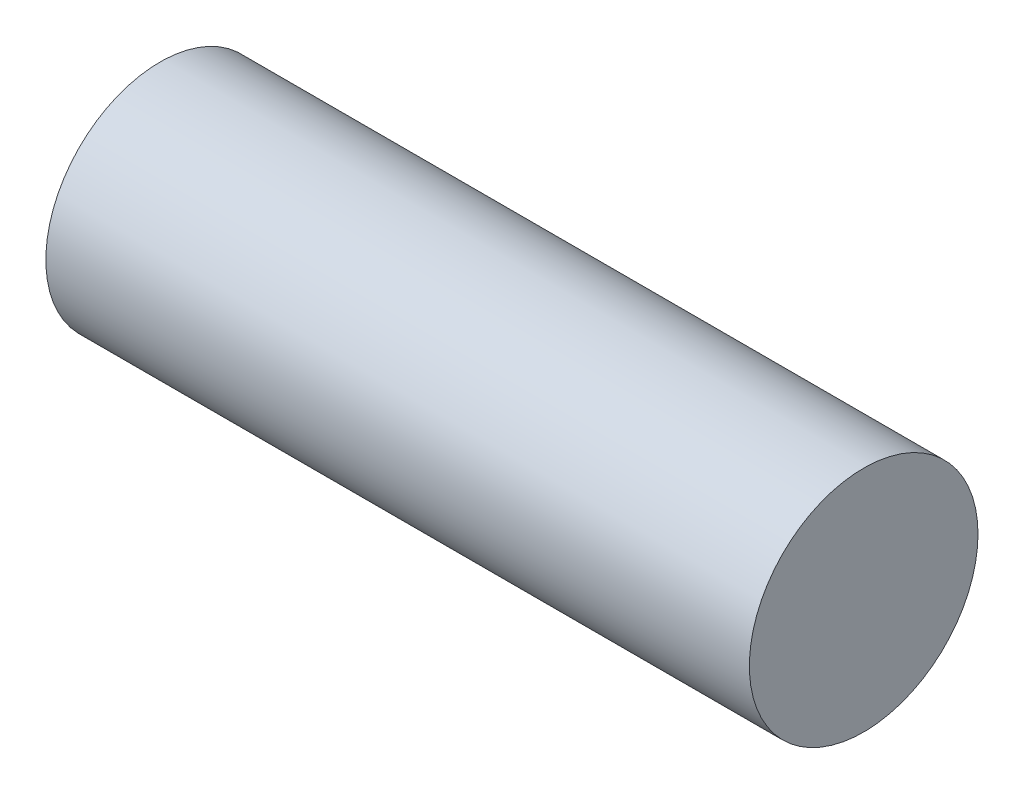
SolidWorks part; units mm, degrees
ref_plane "Front Plane" through (0, 0, 0) normal (0, 0, 1) x (1, 0, 0)
ref_plane "Top Plane" through (0, 0, 0) normal (0, 1, 0) x (1, 0, 0)
ref_plane "Right Plane" through (0, 0, 0) normal (1, 0, 0) x (0, 0, -1)
sketch "Sketch1" plane through (0, 0, 0) normal (1, 0, 0) x (0, 0, -1)
  circle A0 centre (0, 0) radius 2.6
  dimension "D1" = 5.2
extrude "Boss-Extrude1" add sketch "Sketch1" along normal mid plane 16
